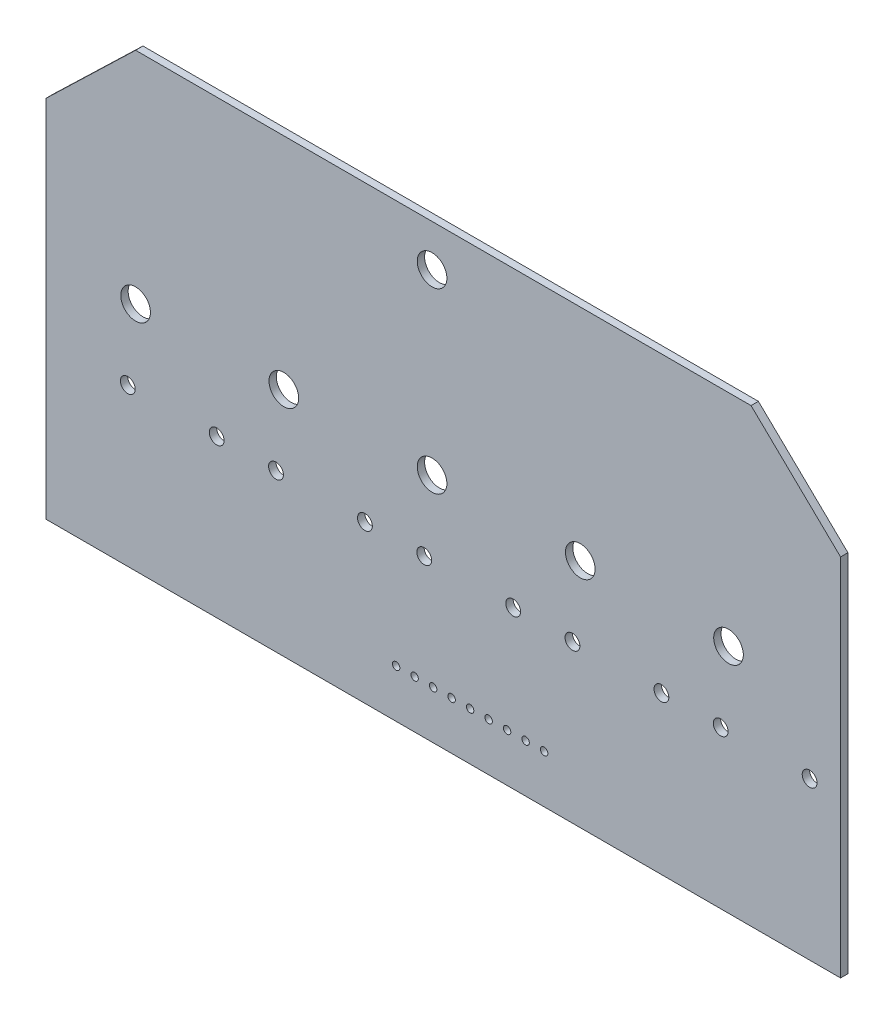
SolidWorks part; units mm, degrees
ref_plane "Front Plane" through (0, 0, 0) normal (0, 0, 1) x (1, 0, 0)
ref_plane "Top Plane" through (0, 0, 0) normal (0, 1, 0) x (1, 0, 0)
ref_plane "Right Plane" through (0, 0, 0) normal (1, 0, 0) x (0, 0, -1)
sketch "Sketch1" plane through (0, 0, 0) normal (0, 0, 1) x (1, 0, 0)
  line L0 (0, 0) -> (0, 67.3419) construction
  line L1 (-85.09, -39.0525) -> (85.09, -39.0525)
  line L2 (-85.09, -39.0525) -> (-85.09, 39.0525)
  line L3 (-85.09, 39.0525) -> (85.09, 39.0525) construction
  line L4 (85.09, -39.0525) -> (85.09, 39.0525)
  line L5 (-85.09, -39.0525) -> (85.09, 39.0525) construction
  line L6 (-85.09, 39.0525) -> (85.09, -39.0525) construction
  line L7 (-65.913, 57.5437) -> (65.913, 57.5437)
  line L8 (-85.09, 39.0525) -> (-65.913, 57.5437)
  line L9 (65.913, 57.5437) -> (85.09, 39.0525)
  point P0 (0, 0)
  point P10 (0, 57.5437)
  dimension "D1" = 170.18
  dimension "D2" = 78.105
  dimension "D3" = 96.5962
  dimension "D4" = 131.826
extrude "Boss-Extrude1" add sketch "Sketch1" along normal blind 1.5748
sketch "Sketch2" plane through (0, 0, 1.5748) normal (0, 0, 1) x (1, 0, 0)
  line L0 (0, 57.5437) -> (0, -45.3273) construction
  line L1 (65.913, 57.5437) -> (-65.913, 57.5437) construction
  line L2 (-65.913, 10.4775) -> (61.087, 10.4775) construction
  line L3 (-85.09, -39.0525) -> (85.09, -39.0525) construction
  line L4 (85.09, -39.0525) -> (85.09, 39.0525) construction
  circle A0 centre (-65.913, 10.4775) radius 3.175
  circle A1 centre (61.087, 10.4775) radius 3.175
  circle A2 centre (-34.163, 10.4775) radius 3.175
  circle A3 centre (29.337, 10.4775) radius 3.175
  circle A4 centre (-2.413, 10.4775) radius 3.175
  circle A5 centre (-2.413, 48.5775) radius 3.175
  dimension "D3" = 6.35
  dimension "D4" = 31.75
  dimension "D5" = 31.75
  dimension "D6" = 6.35
  dimension "D7" = 38.1
  dimension "D8" = 31.75
  dimension "D9" = 24.003
  dimension "D1" = 127
  dimension "D2" = 49.53
extrude "Cut-Extrude1" cut sketch "Sketch2" against normal blind 4.1148
sketch "Sketch3" plane through (0, 0, 1.5748) normal (0, 0, 1) x (1, 0, 0)
  line L0 (78.4606, -5.3975) -> (-78.0401, -5.3975) construction
  line L1 (85.09, -39.0525) -> (85.09, 39.0525) construction
  circle A0 centre (78.4606, -5.3975) radius 1.5875
  circle A1 centre (59.4106, -5.3975) radius 1.5875
  circle A2 centre (46.7106, -5.3975) radius 1.5875
  circle A3 centre (27.6606, -5.3975) radius 1.5875
  circle A4 centre (14.9606, -5.3975) radius 1.5875
  circle A5 centre (-4.0894, -5.3975) radius 1.5875
  circle A6 centre (-16.7894, -5.3975) radius 1.5875
  circle A7 centre (-35.8394, -5.3975) radius 1.5875
  circle A8 centre (-48.5394, -5.3975) radius 1.5875
  circle A9 centre (-67.5894, -5.3975) radius 1.5875
  circle A10 centre (61.087, 10.4775) radius 3.175 construction
  dimension "D1" = 3.175
  dimension "D2" = 19.05
  dimension "D3" = 19.05
  dimension "D4" = 19.05
  dimension "D5" = 19.05
  dimension "D6" = 19.05
  dimension "D7" = 31.75
  dimension "D8" = 31.75
  dimension "D9" = 31.75
  dimension "D10" = 31.75
  dimension "D11" = 6.6294
  dimension "D12" = 15.875
extrude "Cut-Extrude2" cut sketch "Sketch3" against normal through all
sketch "Sketch4" plane through (0, 0, 1.5748) normal (0, 0, 1) x (1, 0, 0)
  line L0 (-28.6724, -28.7655) -> (21.59, -28.7655) construction
  line L1 (-85.09, -39.0525) -> (85.09, -39.0525) construction
  line L2 (85.09, -39.0525) -> (85.09, 39.0525) construction
  circle A0 centre (21.59, -28.7655) radius 0.7937
  circle A1 centre (17.6276, -28.7655) radius 0.7937
  circle A2 centre (13.6652, -28.7655) radius 0.7937
  circle A3 centre (9.7028, -28.7655) radius 0.7937
  circle A4 centre (5.7404, -28.7655) radius 0.7937
  circle A5 centre (1.778, -28.7655) radius 0.7937
  circle A6 centre (-2.1844, -28.7655) radius 0.7937
  circle A7 centre (-6.1468, -28.7655) radius 0.7937
  circle A8 centre (-10.1092, -28.7655) radius 0.7937
  dimension "D1" = 1.5875
  dimension "D2" = 3.9624
  dimension "D3" = 3.9624
  dimension "D4" = 3.9624
  dimension "D5" = 3.9624
  dimension "D6" = 3.9624
  dimension "D7" = 3.9624
  dimension "D8" = 3.9624
  dimension "D9" = 3.9624
  dimension "D11" = 63.5
  dimension "D10" = 10.287
extrude "Cut-Extrude3" cut sketch "Sketch4" against normal through all
